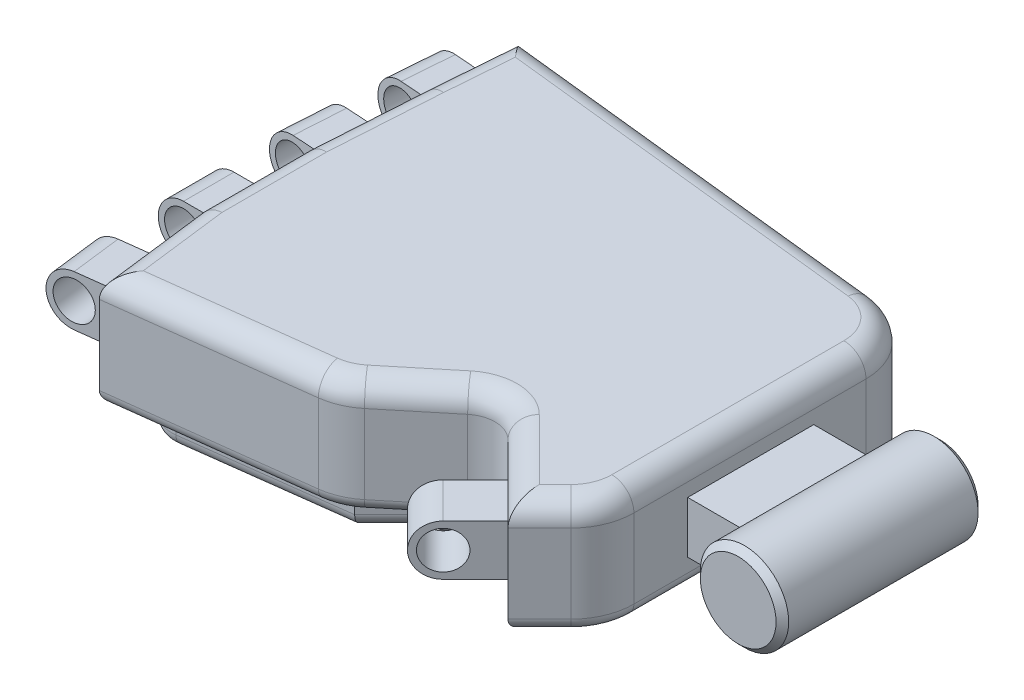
SolidWorks part; units mm, degrees
ref_plane "Front Plane" through (0, 0, 0) normal (0, 0, 1) x (1, 0, 0)
ref_plane "Top Plane" through (0, 0, 0) normal (0, 1, 0) x (1, 0, 0)
ref_plane "Right Plane" through (0, 0, 0) normal (1, 0, 0) x (0, 0, -1)
sketch "Sketch1" plane through (0, 0, 0) normal (0, 1, 0) x (1, 0, 0)
  line L0 (-58.945, 31.7239) -> (3.7689, 24.9149)
  line L1 (9.7606, -28.8604) -> (4.7901, -33.831)
  line L2 (-58.945, -34.8256) -> (-28.0914, -30.9948)
  line L3 (12.6896, -21.7894) -> (12.6896, 14.9734)
  line L4 (-58.945, -34.8256) -> (-61.1698, -16.9067)
  line L5 (-61.1698, -16.9067) -> (-61.1698, 0)
  line L6 (-61.1698, 0) -> (-60.0574, 17.5651)
  line L7 (-60.0574, 17.5651) -> (-58.945, 31.7239)
  line L8 (4.7901, -33.831) -> (-7.2928, -21.7482)
  line L9 (-14.0037, -21.4214) -> (-22.9728, -28.7955)
  arc A0 (9.7606, -28.8604) -> (12.6896, -21.7894) centre (2.6896, -21.7894) ccw
  arc A1 (3.7689, 24.9149) -> (12.6896, 14.9734) centre (2.6896, 14.9734) cw
  arc A2 (-28.0914, -30.9948) -> (-22.9728, -28.7955) centre (-29.3236, -21.071) ccw
  arc A3 (-7.2928, -21.7482) -> (-14.0037, -21.4214) centre (-10.8283, -25.2837) ccw
  dimension "D1" = 10
  dimension "D2" = 10
  dimension "D3" = 10
  dimension "D4" = 5
extrude "Boss-Extrude1" add sketch "Sketch1" along normal blind 18
fillet "Fillet1" radius 3.5 14 edges at (7.2753, 18, 31.3457) (11.9283, 18, 25.6162) (12.6896, 18, 3.408) (10.1325, 18, -21.6519) (-1.2514, 18, 27.7896) (-10.5852, 18, 20.2896) (-18.4882, 18, 25.1085) (-25.3759, 18, 30.2588) (-27.588, 18, -28.3194) (-59.5012, 18, -24.6445) (-60.6136, 18, -8.7826) (-61.1698, 18, 8.4533) (-60.0574, 18, 25.8661) (-43.5182, 18, 32.9102)
fillet "Fillet2" radius 2 14 edges at (7.2753, 0, 31.3457) (11.9283, 0, 25.6162) (-27.588, 0, -28.3194) (10.1325, 0, -21.6519) (-1.2514, 0, 27.7896) (-10.5852, 0, 20.2896) (-18.4882, 0, 25.1085) (-25.3759, 0, 30.2588) (-60.0574, 0, 25.8661) (12.6896, 0, 3.408) (-43.5182, 0, 32.9102) (-61.1698, 0, 8.4533) (-60.6136, 0, -8.7826) (-59.5012, 0, -24.6445)
sketch "Sketch2" plane through (-62.3084, 0, 7.7362) normal (-0.9924, 0, 0.1232) x (0.1232, 0, 0.9924)
  line L3 (18.2692, 8.25) -> (18.2692, 4.25)
  line L6 (18.2692, 8.25) -> (18.2692, 12.25)
  line L7 (18.2692, 8.25) -> (22.2692, 8.25)
  line L8 (14.2692, 4.25) -> (22.2692, 4.25)
  line L9 (14.2692, 4.25) -> (14.2692, 12.25)
  line L10 (14.2692, 12.25) -> (22.2692, 12.25)
  line L11 (22.2692, 4.25) -> (22.2692, 12.25)
  line L12 (14.2692, 4.25) -> (22.2692, 12.25) construction
  line L13 (14.2692, 12.25) -> (22.2692, 4.25) construction
extrude "Boss-Extrude2" add sketch "Sketch2" along normal blind 15 contours L8 L11 L7 L3 | L10 L9 L8 L3 L6 | L7 L11 L10 L6
sketch "Sketch3" plane through (2.7439, 0, 22.0995) normal (0.1232, 0, 0.9924) x (0.9924, 0, -0.1232)
  circle A0 centre (-70.2868, 8.25) radius 3
extrude "Cut-Extrude1" cut sketch "Sketch3" against normal blind 15
sketch "Sketch4" plane through (2.7439, 0, 22.0995) normal (0.1232, 0, 0.9924) x (0.9924, 0, -0.1232)
  line L0 (-70.2868, 12.25) -> (-77.7868, 12.25)
  line L1 (-77.7868, 12.25) -> (-77.7868, 4.25)
  line L2 (-77.7868, 4.25) -> (-70.2868, 4.25)
  line L3 (-77.7868, 4.25) -> (-62.7868, 4.25) construction
  circle A0 centre (-70.2868, 8.25) radius 4
extrude "Cut-Extrude2" cut sketch "Sketch4" against normal blind 10 contours A0 M3 M4 M5
sketch "Sketch5" plane through (-61.1698, 0, 0) normal (-1, 0, 0) x (0, 0, 1)
  line L0 (8.4533, 8.25) -> (8.4533, 12.25)
  line L1 (8.4533, 8.25) -> (12.4533, 8.25)
  line L3 (4.4533, 4.25) -> (12.4533, 4.25)
  line L4 (4.4533, 4.25) -> (4.4533, 12.25)
  line L5 (4.4533, 12.25) -> (12.4533, 12.25)
  line L6 (12.4533, 4.25) -> (12.4533, 12.25)
  line L7 (4.4533, 4.25) -> (12.4533, 12.25) construction
  line L8 (4.4533, 12.25) -> (12.4533, 4.25) construction
extrude "Boss-Extrude3" add sketch "Sketch5" along normal blind 15 contours L3 L6 L1 L0 L5 L4 | L1 L6 L5 L0
sketch "Sketch6" plane through (0, 0, 4.4533) normal (0, 0, -1) x (-1, 0, 0)
  line L0 (67.9931, 12.25) -> (76.1698, 12.25)
  line L1 (76.1698, 12.25) -> (76.1698, 4.25)
  line L2 (76.1698, 4.25) -> (67.9931, 4.25)
  circle A0 centre (67.9931, 8.25) radius 3
  circle A1 centre (67.9931, 8.25) radius 4
extrude "Cut-Extrude3" cut sketch "Sketch6" against normal blind 12 contours A0 | A1 M2 M3 M4
sketch "Sketch7" plane through (-60.9255, 0, -3.8584) normal (-0.998, 0, -0.0632) x (-0.0632, 0, 0.998)
  line L0 (-4.934, 8.25) -> (-4.934, 12.25)
  line L1 (-4.934, 8.25) -> (-0.934, 8.25)
  line L3 (-8.934, 4.25) -> (-0.934, 4.25)
  line L4 (-8.934, 4.25) -> (-8.934, 12.25)
  line L5 (-8.934, 12.25) -> (-0.934, 12.25)
  line L6 (-0.934, 4.25) -> (-0.934, 12.25)
  line L7 (-8.934, 4.25) -> (-0.934, 12.25) construction
  line L8 (-8.934, 12.25) -> (-0.934, 4.25) construction
extrude "Boss-Extrude4" add sketch "Sketch7" along normal blind 15 contours L3 L6 L1 L0 L5 L4 | L1 L6 L5 L0
sketch "Sketch8" plane through (0.5647, 0, -8.9161) normal (0.0632, 0, -0.998) x (-0.998, 0, -0.0632)
  line L0 (68.5475, 12.25) -> (76.0475, 12.25)
  line L1 (76.0475, 12.25) -> (61.0475, 12.25) construction
  line L2 (76.0475, 12.25) -> (76.0475, 4.25)
  line L3 (76.0475, 4.25) -> (68.5475, 4.25)
  line L4 (76.0475, 4.25) -> (61.0475, 4.25) construction
  circle A0 centre (68.5475, 8.25) radius 3
  circle A1 centre (68.5475, 8.25) radius 4
extrude "Cut-Extrude4" cut sketch "Sketch8" against normal blind 11 contours A0 | A1 M2 M3 M4
sketch "Sketch9" plane through (-61.0605, 0, -4.7973) normal (-0.9969, 0, -0.0783) x (-0.0783, 0, 0.9969)
  line L0 (-19.9083, 8.25) -> (-19.9083, 12.25)
  line L1 (-19.9083, 8.25) -> (-15.9083, 8.25)
  line L3 (-23.9083, 4.25) -> (-15.9083, 4.25)
  line L4 (-23.9083, 4.25) -> (-23.9083, 12.25)
  line L5 (-23.9083, 12.25) -> (-15.9083, 12.25)
  line L6 (-15.9083, 4.25) -> (-15.9083, 12.25)
  line L7 (-23.9083, 4.25) -> (-15.9083, 12.25) construction
  line L8 (-23.9083, 12.25) -> (-15.9083, 4.25) construction
extrude "Boss-Extrude5" add sketch "Sketch9" along normal blind 15 contours L3 L6 L1 L0 L5 L4 | L1 L6 L5 L0
sketch "Sketch10" plane through (1.8726, 0, -23.8349) normal (0.0783, 0, -0.9969) x (-0.9969, 0, -0.0783)
  line L0 (68.6751, 12.25) -> (76.2487, 12.25)
  line L1 (76.2487, 12.25) -> (76.2487, 4.25)
  line L2 (76.2487, 4.25) -> (68.7487, 4.25)
  line L3 (76.2487, 4.25) -> (61.2487, 4.25) construction
  circle A0 centre (68.6751, 8.25) radius 3
  circle A1 centre (68.6751, 8.25) radius 4
extrude "Cut-Extrude5" cut sketch "Sketch10" against normal blind 11 contours A0 | A1 M2 M3 M4
sketch "Sketch11" plane through (-14.5205, 0, 14.5205) normal (-0.7071, 0, 0.7071) x (0.7071, 0, 0.7071)
  line L0 (18.7653, 8.25) -> (18.7653, 12.25)
  line L1 (18.7653, 8.25) -> (22.7653, 8.25)
  line L3 (14.7653, 4.25) -> (22.7653, 4.25)
  line L4 (14.7653, 4.25) -> (14.7653, 12.25)
  line L5 (14.7653, 12.25) -> (22.7653, 12.25)
  line L6 (22.7653, 4.25) -> (22.7653, 12.25)
  line L7 (14.7653, 4.25) -> (22.7653, 12.25) construction
  line L8 (14.7653, 12.25) -> (22.7653, 4.25) construction
extrude "Boss-Extrude6" add sketch "Sketch11" along normal blind 15 contours L3 L6 L1 L0 L5 L4 | L1 L6 L5 L0
sketch "Sketch12" plane through (16.0975, 0, 16.0975) normal (0.7071, 0, 0.7071) x (0.7071, 0, -0.7071)
  line L0 (-27.7977, 12.25) -> (-35.535, 12.25)
  line L1 (-35.535, 12.25) -> (-20.535, 12.25) construction
  line L2 (-35.535, 12.25) -> (-35.535, 4.25)
  line L3 (-35.535, 4.25) -> (-35.535, 12.25) construction
  line L4 (-35.535, 4.25) -> (-27.7977, 4.25)
  circle A0 centre (-27.7977, 8.25) radius 3
  circle A1 centre (-27.7977, 8.25) radius 4
extrude "Cut-Extrude7" cut sketch "Sketch12" against normal blind 10 contours A0 | A1 M2 M3 M4
sketch "Sketch14" plane through (0, 0, 0) normal (0, -1, 0) x (1, 0, 0)
  circle A0 centre (-29.6788, 0) radius 18.5669
  circle A1 centre (-29.6788, 0) radius 11.6667
extrude "Boss-Extrude7" add sketch "Sketch14" along normal blind 9
fillet "Fillet3" radius 1.5 1 edges at (-29.6788, -9, -11.6667)
fillet "Fillet4" radius 2.5 1 edges at (-29.6788, -9, -18.5669)
sketch "Sketch15" plane through (0, 0, 0) normal (0, -1, 0) x (1, 0, 0)
  line L0 (-22.2021, 16.9949) -> (-18.6161, 20.5809)
  line L1 (-18.6161, 20.5809) -> (-25.6799, 27.6448)
  line L2 (-25.6799, 27.6448) -> (-50.7865, 30.8604)
  line L3 (-56.3812, 26.5361) -> (-57.6032, 16.9949)
  line L4 (-57.6032, 16.9949) -> (-57.6032, 0)
  line L5 (-57.6032, 0) -> (-48.2457, 0)
  circle A0 centre (-29.6788, 0) radius 18.5669 construction
  circle A1 centre (-29.6788, 0) radius 18.5669
  arc A2 (-56.3812, 26.5361) -> (-50.7865, 30.8604) centre (-51.4217, 25.9009) cw
  dimension "D1" = 5
extrude "Boss-Extrude8" add sketch "Sketch15" along normal blind 4 contours L4 L5 L0 L1 L2 L3 M1
fillet "Fillet5" radius 2 5 edges at (-57.6032, -4, 8.4975) (-56.9922, -4, 21.7655) (-38.2332, -4, 29.2526) (-22.148, -4, 24.1128) (-54.4794, -4, 29.8569)
sketch "Sketch16" plane through (0, 0, 0) normal (0, -1, 0) x (1, 0, 0)
  line L0 (-47.9723, -3.175) -> (-56.7973, -4.7067)
  line L1 (-56.7973, -4.7067) -> (-55.7459, -17.2322)
  line L2 (-55.7459, -17.2322) -> (-55.3164, -22.3494)
  line L3 (-49.9157, -26.9136) -> (-16.7614, -24.1306)
  line L4 (-16.7614, -24.1306) -> (-20.9162, -16.3691)
  arc A0 (-48.2457, 0) -> (-22.2021, 16.9949) centre (-29.6788, 0) ccw construction
  circle A1 centre (-29.6788, 0) radius 18.5669 construction
  circle A2 centre (-29.6788, 0) radius 18.5669
  arc A3 (-49.9157, -26.9136) -> (-55.3164, -22.3494) centre (-50.3339, -21.9311) cw
  dimension "D1" = 5
extrude "Boss-Extrude9" add sketch "Sketch16" along normal blind 4 contours L3 L4 L0 L1 L2 M15
fillet "Fillet6" radius 2 3 edges at (-33.3385, -4, -25.5221) (-56.0569, -4, -13.528) (-53.5613, -4, -25.75)
sketch "Sketch17" plane through (0, 0, 0) normal (0, -1, 0) x (1, 0, 0)
  line L0 (-13.7584, 9.5536) -> (-0.7194, 19.3704)
  line L1 (6.2335, -14.9094) -> (6.2335, 15.8104)
  line L2 (5.87, 17.5822) -> (5.3777, 18.7316)
  line L3 (4.1756, -17.37) -> (-9.7626, -19.8743)
  line L4 (-12.0418, -19.1093) -> (-17.0861, -13.6438)
  arc A0 (-20.9162, -16.3691) -> (-22.2021, 16.9949) centre (-29.6788, 0) ccw construction
  circle A1 centre (-29.6788, 0) radius 18.626
  arc A2 (3.8713, 20.1186) -> (-0.7194, 19.3704) centre (2.2879, 15.3759) ccw
  arc A3 (3.8713, 20.1186) -> (5.3777, 18.7316) centre (3.0796, 17.7473) cw
  arc A4 (-12.0418, -19.1093) -> (-9.7626, -19.8743) centre (-10.2047, -17.4137) ccw
  arc A5 (4.1756, -17.37) -> (6.2335, -14.9094) centre (3.7335, -14.9094) ccw
  arc A6 (6.2335, 15.8104) -> (5.87, 17.5822) centre (1.7335, 15.8104) ccw
  dimension "D1" = 5
  dimension "D2" = 2.5
  dimension "D3" = 2.5
  dimension "D4" = 4.5
extrude "Boss-Extrude10" add sketch "Sketch17" along normal blind 5
fillet "Fillet9" radius 2.5 10 edges at (-14.5439, -5, -16.3983) (-11.0002, -5, -19.7837) (-2.7935, -5, -18.6222) (5.6512, -5, -16.5133) (6.2335, -5, 0.4505) (6.1417, -5, 16.7147) (5.6239, -5, 18.1569) (4.773, -5, 19.5864) (1.4836, -5, 20.3108) (-7.2152, -5, 14.4799)
sketch "Sketch20" plane through (0, -4, 0) normal (0, -1, 0) x (-1, 0, 0)
  circle A0 centre (47.4032, -20.2391) radius 4.659
extrude "Boss-Extrude11" add sketch "Sketch20" along normal blind 1
sketch "Sketch21" plane through (0, -5, 0) normal (0, -1, 0) x (1, 0, 0)
  line L0 (-48.5565, 23.9735) -> (-48.2547, 16.4246)
  line L2 (-46.5517, 24.0536) -> (-46.2499, 16.5047)
  arc A0 (-48.5565, 23.9735) -> (-48.2547, 16.4246) centre (-47.4032, 20.2391) ccw
  arc A1 (-46.2499, 16.5047) -> (-46.5517, 24.0536) centre (-47.4032, 20.2391) ccw
extrude "Boss-Extrude12" add sketch "Sketch21" along normal blind 1
sketch "Sketch22" plane through (12.6896, 0, 0) normal (1, 0, 0) x (0, 0, -1)
  line L1 (-13.2701, 4.1677) -> (6.7009, 4.1677)
  line L2 (-13.2701, 4.1677) -> (-13.2701, 12.375)
  line L3 (-13.2701, 12.375) -> (6.7009, 12.375)
  line L4 (6.7009, 4.1677) -> (6.7009, 12.375)
  line L5 (-13.2701, 4.1677) -> (6.7009, 12.375) construction
  line L6 (-13.2701, 12.375) -> (6.7009, 4.1677) construction
  point P0 (-3.2846, 8.2714)
extrude "Boss-Extrude13" add sketch "Sketch22" along normal blind 14
sketch "Sketch23" plane through (0, 0, 13.2701) normal (0, 0, 1) x (1, 0, 0)
  line L0 (26.6896, 12.375) -> (26.6896, 4.1677) construction
  circle A0 centre (26.6896, 8.2714) radius 7
extrude "Boss-Extrude14" add sketch "Sketch23" along normal blind 6
sketch "Sketch24" plane through (0, 0, 13.2701) normal (0, 0, -1) x (-1, 0, 0)
  line L0 (-26.6896, 4.1677) -> (-26.6896, 12.375) construction
  circle A0 centre (-26.6896, 8.2714) radius 7
extrude "Boss-Extrude15" add sketch "Sketch24" along normal blind 26
chamfer "Chamfer1" distance 1 angle 45 2 edges at (19.6896, 8.2714, -12.7299) (33.6896, 8.2714, 19.2701)
